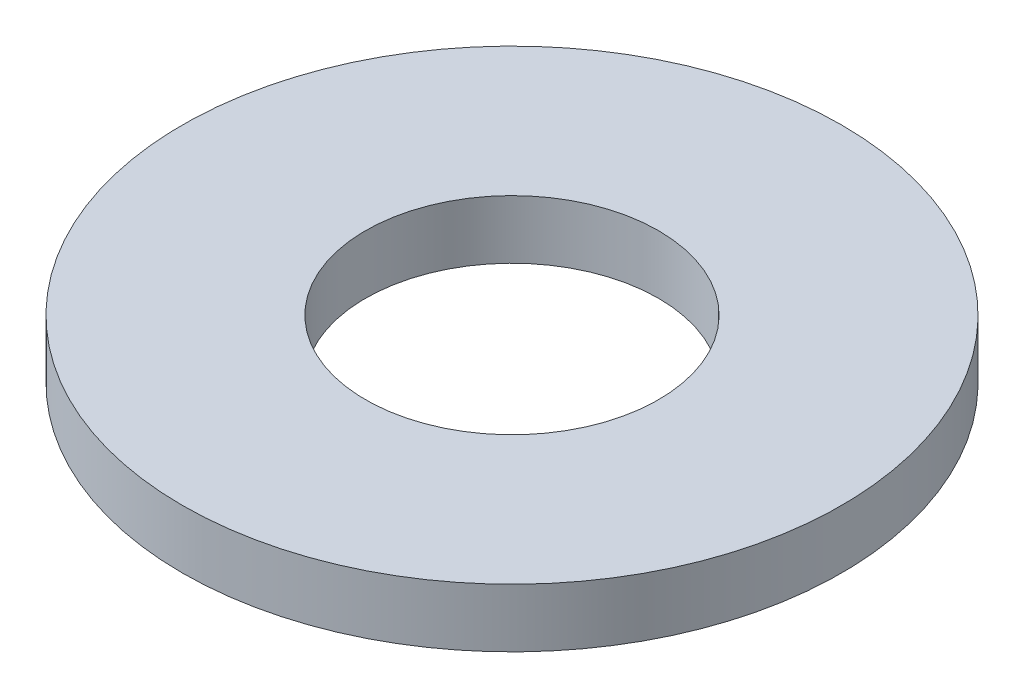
SolidWorks part; units mm, degrees
ref_plane "Plan de face" through (0, 0, 0) normal (0, 0, 1) x (1, 0, 0)
ref_plane "Plan de dessus" through (0, 0, 0) normal (0, 1, 0) x (1, 0, 0)
ref_plane "Plan de droite" through (0, 0, 0) normal (1, 0, 0) x (0, 0, -1)
sketch "Esquisse1" plane through (0, 0, 0) normal (0, 0, 1) x (1, 0, 0)
  line L0 (2, 0.8) -> (2, 0)
  line L1 (2, 0) -> (4.5, 0)
  line L2 (4.5, 0) -> (4.5, 0.8)
  line L3 (4.5, 0.8) -> (2, 0.8)
  line L4 (0, 0.8) -> (0, 0) construction
revolve "Révolution1" add sketch "Esquisse1" angle 360 about L4
